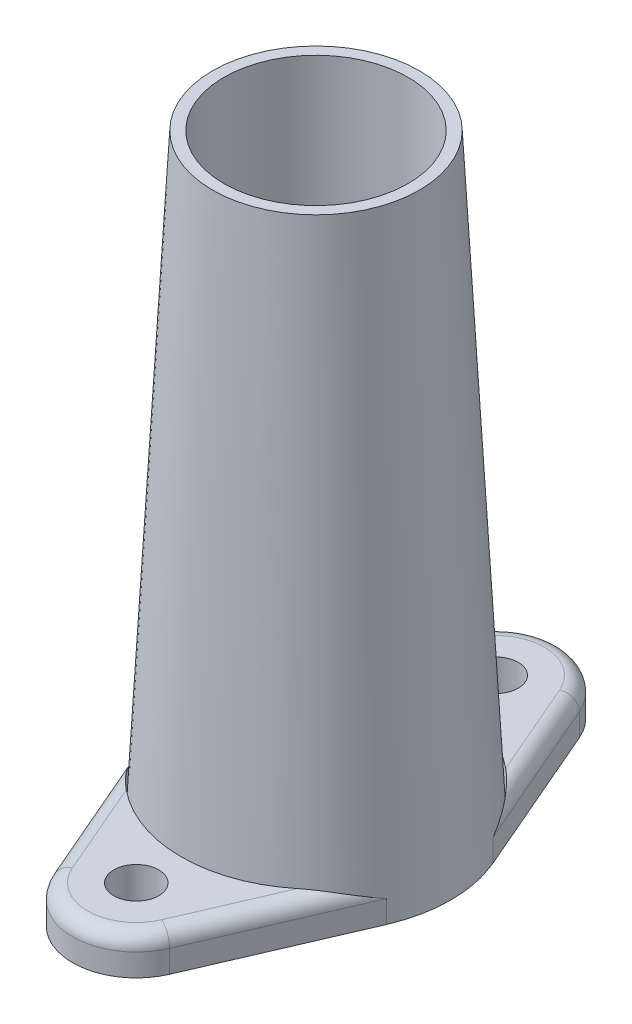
SolidWorks part; units mm, degrees
ref_plane "Plan de face" through (0, 0, 0) normal (0, 0, 1) x (1, 0, 0)
ref_plane "Plan de dessus" through (0, 0, 0) normal (0, 1, 0) x (1, 0, 0)
ref_plane "Plan de droite" through (0, 0, 0) normal (1, 0, 0) x (0, 0, -1)
sketch "Esquisse1" plane through (0, 0, 0) normal (0, 1, 0) x (1, 0, 0)
  circle A0 centre (0, 0) radius 9
  dimension "D1" = 18
extrude "Extrusion1" add sketch "Esquisse1" along normal blind 40 draft 3
sketch "Esquisse2" plane through (0, 40, 0) normal (0, 1, 0) x (-1, 0, 0)
  circle A0 centre (0, 0) radius 6.15
  dimension "D1" = 12.3
extrude "Enlèv. mat.-Extru.1" cut sketch "Esquisse2" against normal blind 37
sketch "Esquisse3" plane through (0, 0, 0) normal (0, -1, 0) x (1, 0, 0)
  line L0 (8.2646, -3.5632) -> (3.9019, -13.6823)
  line L1 (-8.2646, -3.5632) -> (-3.9019, -13.6823)
  line L2 (0, 0) -> (0, -25.0576) construction
  line L3 (0, 0) -> (17.1362, 0) construction
  line L4 (-8.2646, 3.5632) -> (-3.9019, 13.6823)
  line L5 (8.2646, 3.5632) -> (3.9019, 13.6823)
  arc A0 (3.9019, 13.6823) -> (-3.9019, 13.6823) centre (0, 12) ccw
  circle A1 centre (0, 0) radius 9 construction
  arc A2 (3.9019, -13.6823) -> (-3.9019, -13.6823) centre (0, -12) cw
  circle A3 centre (0, -12) radius 1.5
  circle A4 centre (0, 12) radius 1.5
  arc A5 (8.2646, -3.5632) -> (-8.2646, -3.5632) centre (0, 0) cw
  arc A6 (8.2646, 3.5632) -> (-8.2646, 3.5632) centre (0, 0) ccw
  dimension "D1" = 3
  dimension "D2" = 12
extrude "Extrusion2" add sketch "Esquisse3" against normal blind 2.5
fillet "Congé1" radius 1 3 edges at (0, 2.5, -16.2491) (6.0833, 2.5, -8.6227) (-6.0833, 2.5, -8.6227)
fillet "Congé2" radius 1 3 edges at (6.0833, 2.5, 8.6227) (0, 2.5, 16.2491) (-6.0833, 2.5, 8.6227)
sketch "Esquisse4" plane through (0, 0, 0) normal (0, -1, 0) x (1, 0, 0)
  circle A0 centre (0, 0) radius 5
extrude "Enlèv. mat.-Extru.2" cut sketch "Esquisse4" against normal through all
